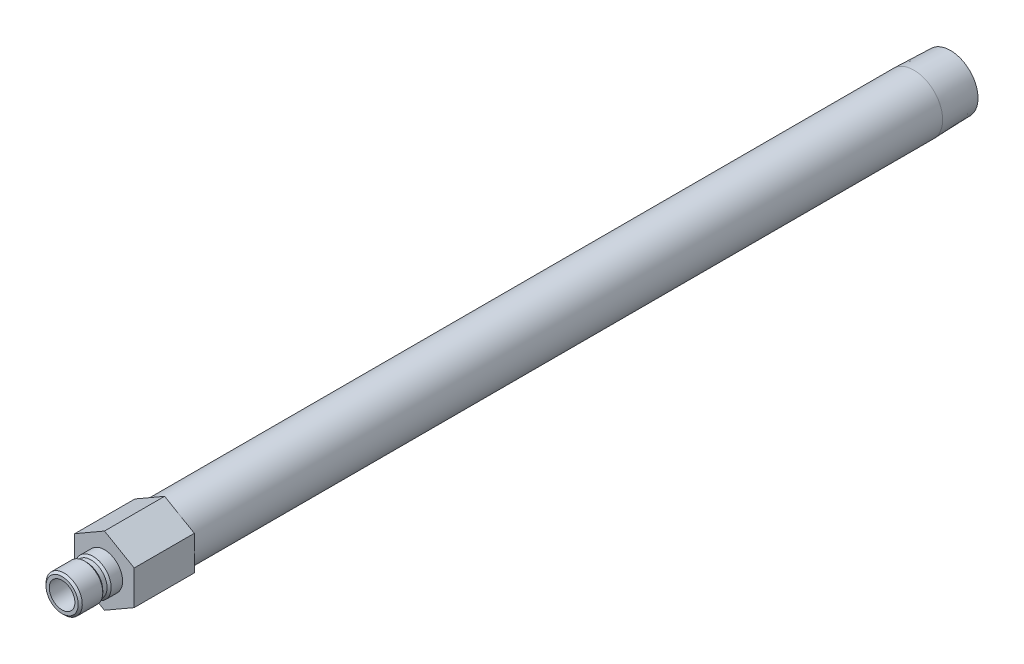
SolidWorks part; units mm, degrees
ref_plane "Front Plane" through (0, 0, 0) normal (0, 0, 1) x (1, 0, 0)
ref_plane "Top Plane" through (0, 0, 0) normal (0, 1, 0) x (1, 0, 0)
ref_plane "Right Plane" through (0, 0, 0) normal (1, 0, 0) x (0, 0, -1)
sketch "Sketch1" plane through (0, 0, 0) normal (1, 0, 0) x (0, 0, -1)
  line L0 (0, 0) -> (-18.923, 0) construction
  line L1 (-15.748, 4.7625) -> (-15.748, 5.9817)
  line L2 (-6.604, 5.9817) -> (-6.604, 0) construction
  line L3 (-14.986, 6.7437) -> (-7.366, 6.7437)
  line L4 (0, 10.668) -> (0, 0) construction
  line L5 (-6.604, 5.9817) -> (-5.0165, 5.9817)
  line L6 (-4.2545, 6.7437) -> (0, 6.7437)
  line L7 (0, 6.7437) -> (0, 10.668)
  line L8 (-6.604, 5.9817) -> (-7.366, 6.7437)
  line L9 (-5.0165, 5.9817) -> (-4.2545, 6.7437)
  line L10 (-15.748, 5.9817) -> (-14.986, 6.7437)
  line L11 (-15.748, 4.7625) -> (22.352, 4.7625)
  line L12 (0, 10.668) -> (300.8884, 10.668)
  line L13 (300.8884, 10.668) -> (314.452, 10.2441)
  line L14 (314.452, 10.2441) -> (314.452, 7.8994)
  line L15 (0, 6.7437) -> (22.352, 6.7437) construction
  line L16 (22.352, 6.7437) -> (22.352, 0) construction
  line L17 (22.352, 0) -> (0, 0) construction
  line L18 (22.352, 4.7625) -> (22.352, 7.8994)
  line L19 (22.352, 7.8994) -> (314.452, 7.8994)
  dimension "D1" = 15.748
  dimension "D2" = 1.5875
  dimension "D3" = 0.762
  dimension "D4" = 45
  dimension "D5" = 9.144
  dimension "D6" = 45
  dimension "D7" = 1.79
  dimension "D8" = 13.5636
  dimension "D9" = 330.2
  dimension "D10" = 3.175
  dimension "D11" = 9.525
  dimension "D12" = 21.336
  dimension "D13" = 38.1
  dimension "D14" = 13.4874
  dimension "D15" = 15.7988
revolve "Revolve1" add sketch "Sketch1" angle 360 about L0
sketch "Sketch2" plane through (0, 0, 0) normal (0, 0, 1) x (1, 0, 0)
  line L1 (-11.049, 6.3791) -> (-11.049, -6.3791)
  line L2 (-11.049, -6.3791) -> (0, -12.7583)
  line L3 (0, -12.7583) -> (11.049, -6.3791)
  line L4 (11.049, -6.3791) -> (11.049, 6.3791)
  line L5 (11.049, 6.3791) -> (0, 12.7583)
  line L6 (0, 12.7583) -> (-11.049, 6.3791)
  circle A0 centre (0, 0) radius 11.049 construction
  circle A1 centre (0, 0) radius 4.7625 construction
  circle A2 centre (0, 0) radius 4.7625
  dimension "D1" = 22.098
extrude "Boss-Extrude1" add sketch "Sketch2" against normal up to vertex (22.352 mm away) from vertex at 0
